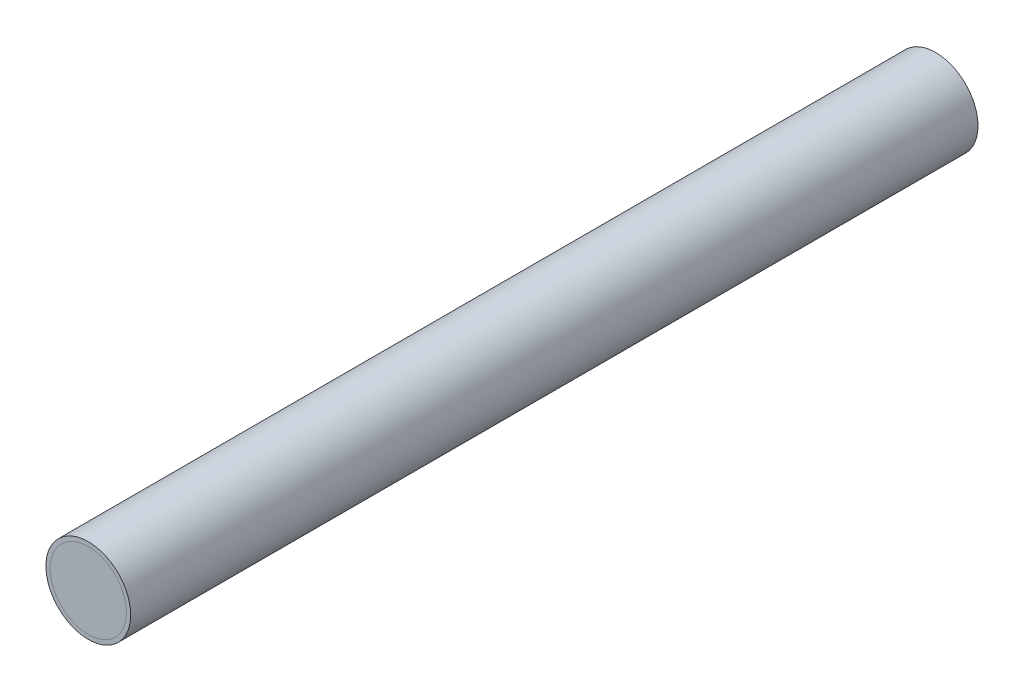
SolidWorks part; units mm, degrees
ref_plane "Front Plane" through (0, 0, 0) normal (0, 0, 1) x (1, 0, 0)
ref_plane "Top Plane" through (0, 0, 0) normal (0, 1, 0) x (1, 0, 0)
ref_plane "Right Plane" through (0, 0, 0) normal (1, 0, 0) x (0, 0, -1)
sketch "Sketch1" plane through (0, 0, 0) normal (0, 0, 1) x (1, 0, 0)
  circle A0 centre (0, 0) radius 50
  dimension "D1" = 100
extrude "Boss-Extrude1" add sketch "Sketch1" along normal blind 1000
sketch "Sketch2" plane through (0, 0, 1000) normal (0, 0, 1) x (1, 0, 0)
  circle A0 centre (0, 0) radius 45
  dimension "D1" = 90
extrude "Cut-Extrude1" cut sketch "Sketch2" against normal blind 400
sketch "Sketch3" plane through (0, 0, 0) normal (0, 0, -1) x (-1, 0, 0)
  circle A0 centre (0, 0) radius 45
  dimension "D1" = 90
extrude "Cut-Extrude2" cut sketch "Sketch3" against normal blind 400
sketch "Sketch7" plane through (0, 0, 400) normal (0, 0, -1) x (-1, 0, 0)
  point P0 (0, 0)
hole_wizard "Ø20.0 (20) Diameter Hole2" positions "3DSketch3" profile "Sketch8" hole size "Ø20.0" standard "ISO"
sketch3d "3DSketch3"
  point P0 (0, 0, 400)
sketch "Sketch8" plane through (0, 0, 400) normal (1, 0, 0) x (0, 1, 0)
  line L0 (0, 0) -> (0, 200)
  line L1 (0, 200) -> (10, 200)
  line L2 (10, 200) -> (10, 0)
  line L5 (10, 0) -> (0, 0)
  line L11 (0, -6.35) -> (0, 107.95) construction
  dimension "Thru Hole Dia." = 20
  dimension "Thru Hole Depth" = 200
chamfer "Chamfer1" distance 30 angle 45 1 edges at (10, 0, 600)
chamfer "Chamfer2" distance 30 angle 80 1 edges at (-10, 0, 400)
imported_body "LID1"
imported_body "LID2"
fillet "Fillet2" radius 10 3 edges at (45, 0, 600) (-10.0208, 0, 570.0208) (-45, 0, 400)
sketch "Sketch10" plane through (0, 0, 0) normal (0, 1, 0) x (1, 0, 0)
  line L0 (0, -19.1367) -> (0, -987.3711)
